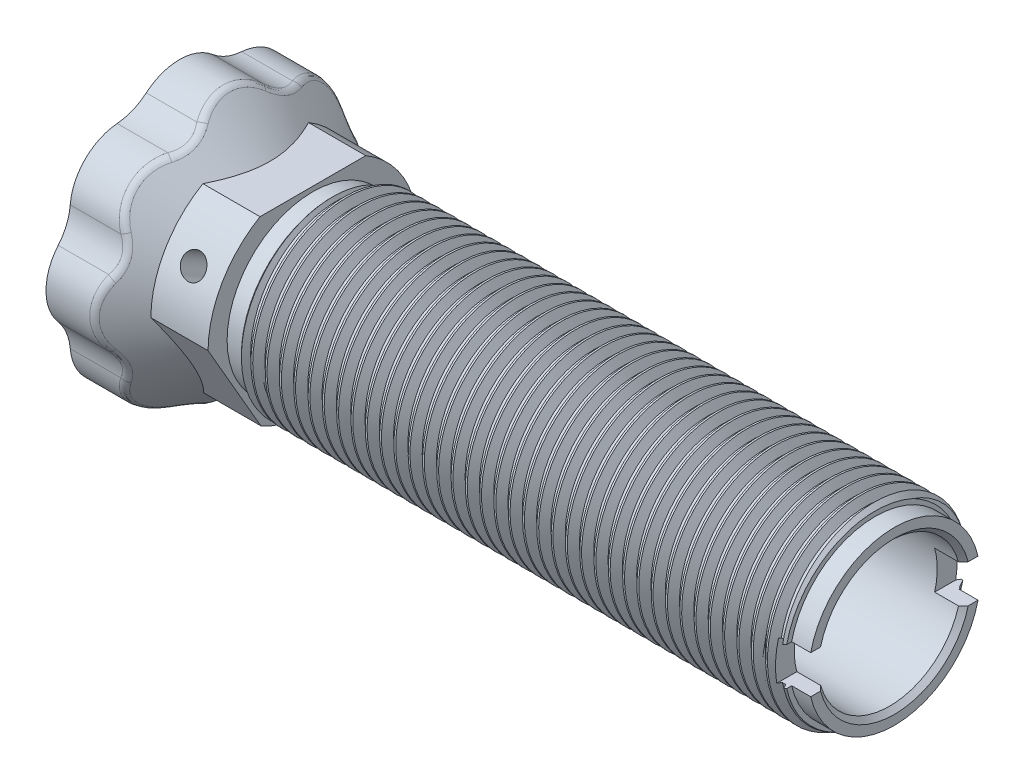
SolidWorks part; units mm, degrees
ref_plane "Front Plane" through (0, 0, 0) normal (0, 0, 1) x (1, 0, 0)
ref_plane "Top Plane" through (0, 0, 0) normal (0, 1, 0) x (1, 0, 0)
ref_plane "Right Plane" through (0, 0, 0) normal (1, 0, 0) x (0, 0, -1)
sketch "Sketch1" plane through (0, 0, 0) normal (0, 0, 1) x (1, 0, 0)
  line L0 (0, 0) -> (-111.8248, 0) construction
  line L1 (-0.5, 7.5) -> (0, 8)
  line L2 (0, 8) -> (0, 9)
  line L3 (0, 9) -> (-2, 9)
  line L4 (-2, 9) -> (-2, 10)
  line L5 (-2, 10) -> (-59, 10)
  line L7 (-61, 11) -> (-67, 11)
  line L8 (-67, 11) -> (-70, 14)
  line L9 (-70, 14) -> (-75, 14)
  line L10 (-75, 14) -> (-75, 10.5)
  line L11 (-75, 10.5) -> (-69, 10.5)
  line L12 (-69, 10.5) -> (-69, 7.5)
  line L13 (-69, 7.5) -> (-0.5, 7.5)
  line L16 (-59, 10) -> (-59, 9)
  line L17 (-59, 9) -> (-61, 9)
  line L18 (-61, 11) -> (-61, 9)
  dimension "D1" = 75
  dimension "D2" = 6.5
  dimension "D3" = 2.5
  dimension "D4" = 3.5
  dimension "D5" = 1
  dimension "D6" = 2
  dimension "D7" = 15
  dimension "D8" = 0.5
  dimension "D9" = 45
  dimension "D10" = 2
  dimension "D11" = 5
  dimension "D12" = 6
  dimension "D13" = 3.5
  dimension "D14" = 1.5
  dimension "D15" = 6
revolve "Revolve1" add sketch "Sketch1" angle 360 about L0
sketch "Sketch2" plane through (-75, 0, 0) normal (-1, 0, 0) x (0, 0, 1)
  arc A1 (3.4835, 12.7199) -> (-3.4835, 12.7199) centre (0, 8.6201) ccw
  circle A4 centre (0, 0) radius 14 construction
  arc A5 (11.4576, 6.5311) -> (6.5311, 11.4576) centre (6.0953, 6.0953) ccw
  arc A6 (12.7199, -3.4835) -> (12.7199, 3.4835) centre (8.6201, 0) ccw
  arc A7 (6.5311, -11.4576) -> (11.4576, -6.5311) centre (6.0953, -6.0953) ccw
  arc A8 (-3.4835, -12.7199) -> (3.4835, -12.7199) centre (0, -8.6201) ccw
  arc A9 (-11.4576, -6.5311) -> (-6.5311, -11.4576) centre (-6.0953, -6.0953) ccw
  arc A10 (-12.7199, 3.4835) -> (-12.7199, -3.4835) centre (-8.6201, 0) ccw
  arc A11 (-6.5311, 11.4576) -> (-11.4576, 6.5311) centre (-6.0953, 6.0953) ccw
  arc A12 (-6.5311, 11.4576) -> (-3.4835, 12.7199) centre (-6.967, 16.8198) ccw
  arc A13 (3.4835, 12.7199) -> (6.5311, 11.4576) centre (6.967, 16.8198) ccw
  arc A14 (11.4576, 6.5311) -> (12.7199, 3.4835) centre (16.8198, 6.967) ccw
  arc A15 (12.7199, -3.4835) -> (11.4576, -6.5311) centre (16.8198, -6.967) ccw
  arc A16 (6.5311, -11.4576) -> (3.4835, -12.7199) centre (6.967, -16.8198) ccw
  arc A17 (-3.4835, -12.7199) -> (-6.5311, -11.4576) centre (-6.967, -16.8198) ccw
  arc A18 (-11.4576, -6.5311) -> (-12.7199, -3.4835) centre (-16.8198, -6.967) ccw
  arc A19 (-12.7199, 3.4835) -> (-11.4576, 6.5311) centre (-16.8198, 6.967) ccw
  circle A20 centre (0, 0) radius 8.6201 construction
  circle A21 centre (0, 0) radius 19.6277
  dimension "D1" = 17.2401
  dimension "D2" = 8
  dimension "D3" = 8
extrude "Cut-Extrude1" cut sketch "Sketch2" against normal through all
chamfer "Chamfer1" distance 0.5 angle 45 2 edges at (-59, 0, -10) (-2, 0, -10)
sketch "Sketch6" plane through (0, 0, 0) normal (0, 0, 1) x (1, 0, 0)
  line L0 (0, -9) -> (0, 9) construction
  line L1 (-3, 2) -> (0, 2)
  line L2 (-3, 2) -> (-3, -2)
  line L3 (-3, -2) -> (0, -2)
  line L4 (0, 2) -> (0, -2)
  dimension "D1" = 3
  dimension "D2" = 4
extrude "Cut-Extrude3" cut sketch "Sketch6" against normal through all both and the other way through all
sketch "Sketch7" plane through (-61, 0, 0) normal (1, 0, 0) x (0, 0, -1)
  line L0 (0, 14.5) -> (0, 0) construction
  line L1 (-7.5, 14.5) -> (7.5, 14.5)
  line L2 (-7.5, 14.5) -> (-7.5, 9.5)
  line L3 (-7.5, 9.5) -> (7.5, 9.5)
  line L4 (7.5, 14.5) -> (7.5, 9.5)
  circle A2 centre (0, 0) radius 9 construction
  dimension "D1" = 0.5
  dimension "D2" = 5
  dimension "D3" = 15
extrude "Cut-Extrude4" cut sketch "Sketch7" against normal up to surface (11.3248 mm away)
pattern_circular "CirPattern1" count 3 over 360 about axis through (0, 0, 0) along (1, 0, 0) of "Cut-Extrude4"
hole_wizard "Ø2.5 (2.5) Diameter Hole1" positions "3DSketch1" profile "Sketch8" hole size "Ø2.5" standard "ANSI Metric"
sketch3d "3DSketch1"
  line L0 (-61, 5.5, 9.5263) -> (-67, 5.5, 9.5263) construction
  line L1 (-61, 5.5, 9.5263) -> (-61, 9.5, 5.5453) construction
  line L2 (-61, 5.5, 9.5263) -> (-61, 0.0523, 10.9999) construction
  arc A2 (-61, 9.5, 5.5453) -> (-61, 0.0523, 10.9999) centre (-61, 0, 0) ccw construction
  point P0 (-64, 5.5, 9.5263)
  point P2 (-64, 5.5, -9.5263)
  point P4 (-64, -11, 0)
  point P31 (-50, 0, 0)
  dimension "D2" = 3
  dimension "D1" = 3
sketch "Sketch8" plane through (-64, 5.5, 9.5263) normal (1, 0, 0) x (0, -0.866, 0.5)
  line L0 (0, 0) -> (0, 3.5)
  line L1 (0, 3.5) -> (1.25, 3.5)
  line L2 (1.25, 3.5) -> (1.25, 0)
  line L5 (1.25, 0) -> (0, 0)
  line L11 (0, -6.35) -> (0, 107.95) construction
  dimension "Thru Hole Dia." = 2.5
  dimension "Thru Hole Depth" = 3.5
chamfer "Chamfer2" distance 0.5 angle 45 2 edges at (-69, 0, -7.5) (-75, 0, -10.5)
fillet "Fillet1" radius 1 16 edges at (-69.9865, 13.9781, -0.4849) (-68.8688, 11.6589, -5.4475) (-69.9865, 9.5412, -10.2269) (-68.8688, 4.3921, -12.0961) (-69.9865, -0.4849, -13.9781) (-68.8688, -5.4475, -11.6589) (-69.9865, -10.2269, -9.5412) (-68.8688, -12.0961, -4.3921) (-69.9865, -13.9781, 0.4849) (-68.8688, -11.6589, 5.4475) (-69.9865, -9.5412, 10.2269) (-68.8688, -4.3921, 12.0961) (-69.9865, 0.4849, 13.9781) (-68.8688, 5.4475, 11.6589) (-69.9865, 10.2269, 9.5412) (-68.8688, 12.0961, 4.3921)
thread "Thread1" pitch 1.5 start angle 0, offset 2, length 0, pitch 1.5, diameter 20
ref_plane "Plane1" through (-0.5, 0, 10) normal (0, -1, 0) x (0, 0, 1)
sketch "Thread Profile1" plane through (-0.5, 0, 10) normal (0, -1, 0) x (0, 0, 1)
  line L0 (0, 0) -> (0, 1.5) construction
  line L11 (0, 0) -> (0, 1.3125)
  line L12 (0, 1.3125) -> (-0.8119, 0.8437)
  line L13 (-0.8119, 0.8437) -> (-0.8119, 0.4687)
  line L15 (-0.8119, 0.4687) -> (0, 0)
  line L17 (-0.8119, 0.6562) -> (0, 0.6562) construction
  point P2 (0, 0)
  dimension "Pitch" = 1.5
  dimension "Profile_Angle" = 60
  dimension "Profile_Land" = 0.375
  dimension "Profile_Height" = 0.8119
sketch3d "CAMWorksSketchPoint"
  point P0 (-292, 0, 0)
  point P1 (576.9, 0, 0)
sketch "Screw_Sketch" plane through (0, 0, 0) normal (0, 0, 1) x (1, 0, 0)
  line L0 (-59, 10) -> (-59, 0)
  line L1 (-59, 0) -> (0, 0)
  line L3 (-18, 10) -> (-37.5, 10)
  line L5 (-37.5, 10) -> (-59, 10)
  line L6 (-20, 0) -> (-20, 18.4466) construction
  line L7 (-40, 0) -> (-40, 19.199) construction
  line L8 (-60, 0) -> (-60, 15.6882) construction
  line L9 (0, 2) -> (0, 9) construction
  line L10 (0, 0) -> (0, 10)
  line L15 (-59, 10) -> (-59, 9)
  line L16 (-59, 9) -> (-61, 9)
  line L17 (-61, 9) -> (-61, 11)
  line L18 (-61, 11) -> (-67, 11)
  line L19 (-67, 11) -> (-70, 14)
  line L20 (-70, 14) -> (-75, 14)
  line L21 (-75, 14) -> (-75, 10.5)
  line L22 (-75, 10.5) -> (-69, 10.5)
  line L23 (-69, 10.5) -> (-69, 7.5)
  line L24 (-69, 7.5) -> (-0.5, 7.5)
  line L25 (-0.5, 7.5) -> (0, 8)
  line L26 (0, 8) -> (0, 9)
  line L27 (0, 9) -> (-2, 9)
  line L28 (-2, 9) -> (-2, 10)
  line L29 (-2, 10) -> (-59, 10)
  line L44 (0, 10) -> (-18, 10)
  dimension "D2" = 18
  dimension "D3" = 37.5
  dimension "D5" = 20
  dimension "D6" = 40
  dimension "D7" = 60
  dimension "D1" = 0
